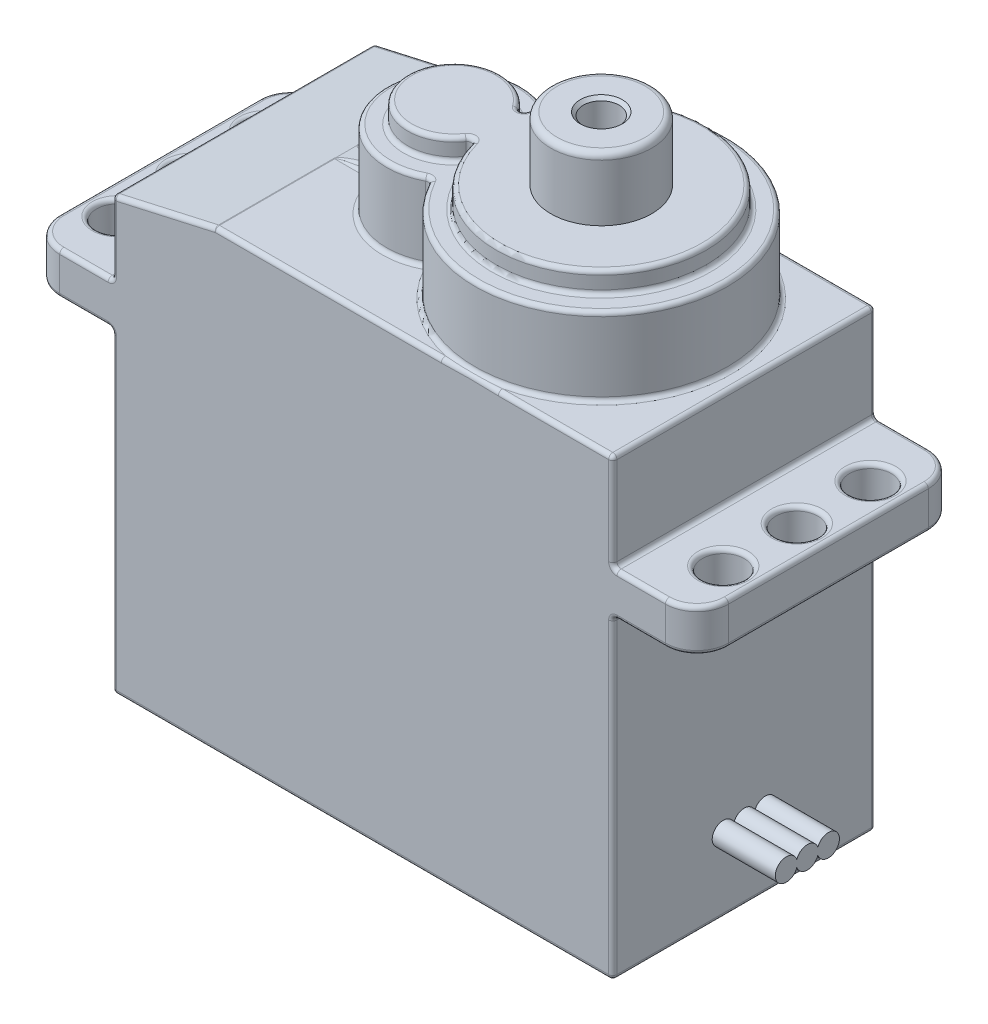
SolidWorks part; units mm, degrees
ref_plane "Plan de face" through (0, 0, 0) normal (0, 0, 1) x (1, 0, 0)
ref_plane "Plan de dessus" through (0, 0, 0) normal (0, 1, 0) x (1, 0, 0)
ref_plane "Plan de droite" through (0, 0, 0) normal (1, 0, 0) x (0, 0, -1)
sketch "Esquisse1" plane through (0, 0, 0) normal (0, 0, 1) x (1, 0, 0)
  line L0 (-11.9, 0) -> (11.9, 0)
  line L1 (-11.9, 0) -> (-11.9, 15)
  line L2 (-11.9, 15) -> (-15.9, 15)
  line L3 (-15.9, 15) -> (-15.9, 17)
  line L4 (-15.9, 17) -> (-11.9, 17)
  line L5 (-11.9, 17) -> (-11.9, 20.5)
  line L6 (-11.9, 20.5) -> (-7.0225, 21.6)
  line L7 (-7.0225, 21.6) -> (11.9, 21.6)
  line L8 (11.9, 21.6) -> (11.9, 17)
  line L9 (11.9, 17) -> (15.9, 17)
  line L10 (15.9, 17) -> (15.9, 15)
  line L11 (15.9, 15) -> (11.9, 15)
  line L12 (11.9, 15) -> (11.9, 0)
  point P3 (0, 0)
  dimension "D1" = 2
  dimension "D2" = 23.8
  dimension "D3" = 21.6
  dimension "D4" = 20.5
  dimension "D5" = 5
  dimension "D6" = 15
  dimension "D7" = 4
extrude "Boss.-Extru.1" add sketch "Esquisse1" along normal blind 12.5
ref_plane "Plan1" through (0, 0, 6.25) normal (0, 0, 1) x (1, 0, 0)
sketch "Esquisse4" plane through (0, 0, 6.25) normal (0, 0, 1) x (1, 0, 0)
  line L0 (5.1, 21.6) -> (5.1, 29.3) construction
  line L1 (11.9, 21.6) -> (-7.0225, 21.6) construction
  line L2 (11.1, 21.6) -> (11.1, 25.3)
  line L3 (11.9, 17) -> (11.9, 21.6) construction
  line L4 (11.1, 25.3) -> (10.1, 25.3)
  line L5 (10.1, 25.3) -> (10.1, 26.3)
  line L6 (10.1, 26.3) -> (7.5, 26.3)
  line L7 (7.5, 26.3) -> (7.5, 29)
  line L8 (7.2, 29.3) -> (6.1, 29.3)
  line L9 (11.1, 21.6) -> (5.95, 21.6)
  line L10 (6.1, 29.3) -> (5.95, 29.15)
  line L11 (5.95, 29.15) -> (5.95, 21.6)
  arc A0 (7.5, 29) -> (7.2, 29.3) centre (7.2, 29) ccw
  point P6 (7.5, 27.65)
  point P13 (5.95, 29.3)
  point P16 (7.5, 29.3)
  dimension "D7" = 0.3
  dimension "D1" = 0.8
  dimension "D2" = 1
  dimension "D3" = 6
  dimension "D4" = 2.4
  dimension "D5" = 3
  dimension "D6" = 1
  dimension "D8" = 7.7
  dimension "D9" = 0.85
revolve "Révolution1" add sketch "Esquisse4" angle 360 about L0
sketch "Esquisse5" plane through (0, 0, 6.25) normal (0, 0, 1) x (1, 0, 0)
  line L0 (-1.9, 21.6) -> (-1.9, 27.1062) construction
  line L1 (11.9, 21.6) -> (-7.0225, 21.6) construction
  line L2 (-0.9, 25.3) -> (-0.9, 21.6) construction
  line L3 (-4.1, 25.3) -> (-5.1, 25.3)
  line L4 (-5.1, 25.3) -> (-5.1, 21.6)
  line L5 (-5.1, 21.6) -> (-1.9, 21.6)
  line L6 (-1.9, 21.6) -> (-1.9, 26.3)
  line L7 (-4.1, 25.3) -> (-4.1, 26.3)
  line L8 (-4.1, 26.3) -> (-1.9, 26.3)
  line L9 (0.1, 26.3) -> (0.1, 25.3) construction
  dimension "D1" = 1
  dimension "D2" = 3.2
  dimension "D3" = 1
revolve "Révolution3" add sketch "Esquisse5" angle 360 about L0
sketch "Esquisse6" plane through (0, 0, 6.25) normal (0, 0, 1) x (1, 0, 0)
  line L0 (-7.0225, 21.6) -> (-4.7225, 22.1)
  line L2 (-4.7225, 22.1) -> (-4.7225, 21.6)
  line L3 (-4.7225, 21.6) -> (-7.0225, 21.6)
  dimension "D1" = 0.5
  dimension "D2" = 2.3
extrude "Boss.-Extru.2" add sketch "Esquisse6" along normal mid plane 0.75
sketch "Esquisse7" plane through (11.9, 0, 0) normal (1, 0, 0) x (0, 0, -1)
  line L0 (-6.25, 15.8544) -> (-6.25, -15.8544) construction
  line L1 (-12.5, 0) -> (0, 0) construction
  line L2 (-7.25, 3.5) -> (-5.25, 3.5) construction
  arc A0 (-6.75, 3.3399) -> (-5.75, 3.3399) centre (-6.25, 3.5) ccw
  arc A1 (-6.75, 3.6601) -> (-6.75, 3.3399) centre (-7.25, 3.5) ccw
  arc A2 (-6.75, 3.3399) -> (-5.75, 3.3399) centre (-6.25, 3.5) ccw
  arc A3 (-5.75, 3.3399) -> (-5.75, 3.6601) centre (-5.25, 3.5) ccw
  arc A4 (-5.75, 3.6601) -> (-6.75, 3.6601) centre (-6.25, 3.5) ccw
  arc A5 (-5.75, 3.6601) -> (-6.75, 3.6601) centre (-6.25, 3.5) ccw
  dimension "D1" = 1.05
  dimension "D2" = 3.5
  dimension "D6" = 2
  dimension "D3" = 2
  dimension "D4" = 2
extrude "Boss.-Extru.4" add sketch "Esquisse7" along normal blind 3
sketch "Esquisse8" plane through (0, 17, 0) normal (0, 1, 0) x (1, 0, 0)
  line L0 (-15.8544, -6.25) -> (15.8544, -6.25) construction
  line L1 (-11.9, -12.5) -> (-11.9, 0) construction
  line L2 (-14.4, -10.8881) -> (-14.4, -2.2181) construction
  line L3 (-11.9, -12.5) -> (-11.9, 0) construction
  line L4 (14.4, -9.75) -> (14.4, -2.75) construction
  line L5 (15.9, -12.5) -> (15.9, 0) construction
  circle A0 centre (-14.4, -6.25) radius 1
  circle A1 centre (-14.4, -2.75) radius 1
  circle A2 centre (14.4, -2.75) radius 1
  circle A3 centre (14.4, -6.25) radius 1
  circle A4 centre (14.4, -9.75) radius 1
  circle A5 centre (-14.4, -6.25) radius 1
  circle A6 centre (-14.4, -9.75) radius 1
  point P16 (15.9, -6.25)
  dimension "D1" = 2
  dimension "D3" = 3.5
  dimension "D2" = 2.5
  dimension "D4" = 2
  dimension "D6" = 7
  dimension "D7" = 1.5
  dimension "D5" = 3
extrude "Enlèv. mat.-Extru.1" cut sketch "Esquisse8" against normal up to next
fillet "Congé1" radius 1.5 4 edges at (15.9, 16, 12.5) (15.9, 16, 0) (-15.9, 16, 0) (-15.9, 16, 12.5)
fillet "Congé47" radius 0.2 10 edges at (-6.0502, 21.6, 6.625) (-6.0502, 21.6, 5.875) (-5.078, 21.8114, 5.875) (-5.1, 22.0179, 6.25) (-5.078, 21.8114, 6.625) (-3.3033, 21.6, 9.1259) (-0.24, 23.45, 3.5142) (-0.24, 23.45, 8.9858) (11.1, 21.6, 6.25) (-3.3033, 21.6, 3.3741)
fillet "Congé48" radius 0.2 18 edges at (-0.2628, 25.3, 3.4311) (-0.2628, 25.3, 9.0689) (-5.1, 25.3, 6.25) (11.1, 25.3, 6.25) (-5.1259, 22.0496, 5.831) (-7.0225, 21.6, 2.8375) (-6.753, 21.6586, 5.8164) (-5.1259, 22.0496, 6.669) (-7.0225, 21.6, 9.6625) (-6.753, 21.6586, 6.6836) (0.16, 25.8, 5.4777) (-4.1, 25.3, 6.25) (0.16, 25.8, 7.0223) (-4.1, 26.3, 6.25) (10.1, 25.3, 6.25) (10.1, 26.3, 6.25) (-5.6768, 21.8926, 5.875) (-5.6768, 21.8926, 6.625)
fillet "Congé49" radius 0.2 56 edges at (-15.4607, 17, 0.4393) (-15.4607, 17, 12.0607) (15.4607, 17, 0.4393) (15.4607, 17, 12.0607) (-15.4607, 15, 0.4393) (-15.4607, 15, 12.0607) (15.4607, 15, 12.0607) (15.4607, 15, 0.4393) (13.4, 15, 6.25) (14.4, 17, 7.25) (13.4, 15, 9.75) (14.4, 17, 10.75) (-13.15, 17, 0) (-15.9, 17, 6.25) (-13.15, 17, 12.5) (-11.9, 18.75, 12.5) (-11.9, 17, 6.25) (-11.9, 18.75, 0) (-11.9, 20.5, 6.25) (-9.4721, 21.0475, 0) (2.4499, 21.6, 0) (11.9, 21.6, 6.25) (11.9, 19.3, 0) (11.9, 17, 6.25) (13.15, 17, 0) (15.9, 17, 6.25) (13.15, 17, 12.5) (11.9, 19.3, 12.5) (2.4499, 21.6, 12.5) (-9.4721, 21.0475, 12.5) (-14.4, 15, 10.75) (-14.4, 17, 10.75) (-14.4, 15, 3.75) (-14.4, 17, 3.75) (-11.9, 7.5, 0) (-11.9, 15, 6.25) (-13.15, 15, 0) (-15.9, 15, 6.25) (-13.15, 15, 12.5) (-11.9, 7.5, 12.5) (13.15, 15, 12.5) (11.9, 15, 6.25) (11.9, 7.5, 12.5) (11.9, 0, 6.25) (0, 0, 12.5) (-11.9, 0, 6.25) (0, 0, 0) (11.9, 7.5, 0) (13.15, 15, 0) (15.9, 15, 6.25) (-14.4, 15, 7.25) (-14.4, 17, 7.25) (13.4, 15, 2.75) (14.4, 17, 3.75) (-7.0224, 21.5988, 0) (-7.0224, 21.5988, 12.5)
